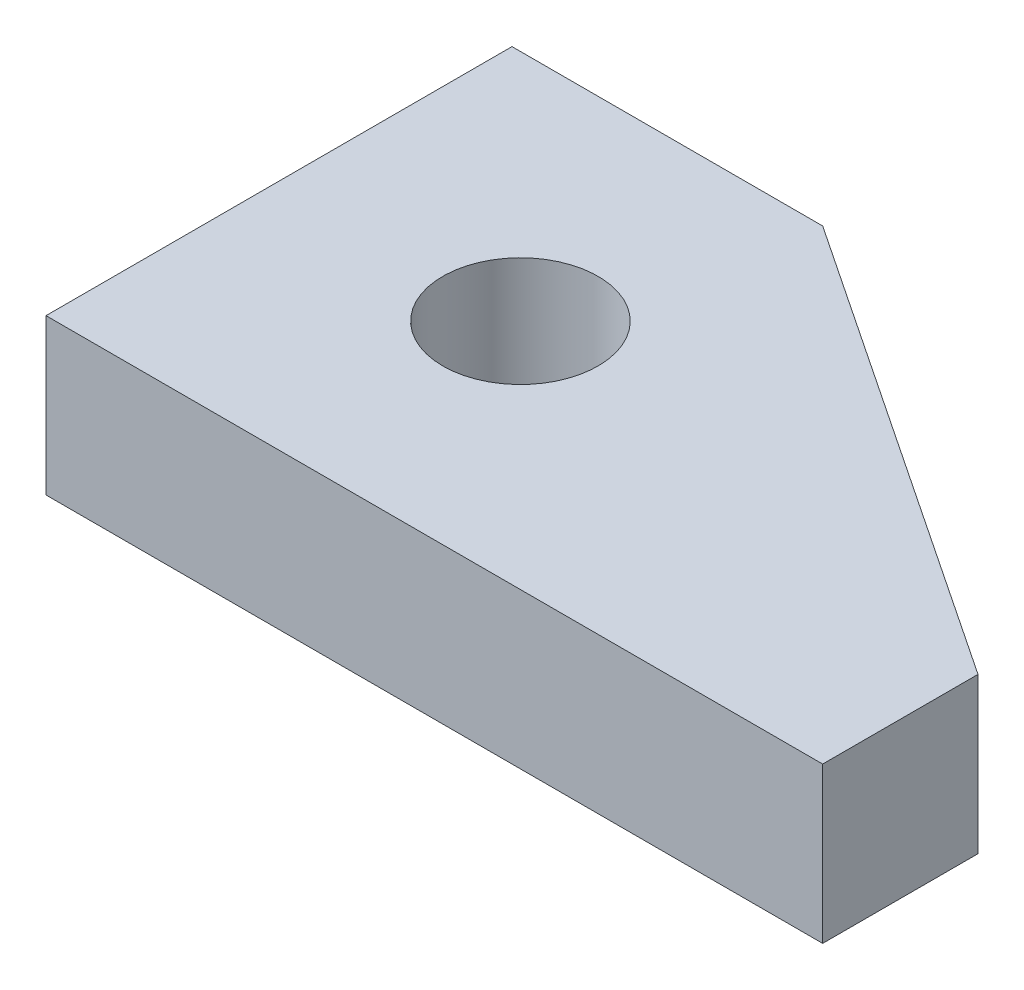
SolidWorks part; units mm, degrees
ref_plane "Plano frontal" through (0, 0, 0) normal (0, 0, 1) x (1, 0, 0)
ref_plane "Plano superior" through (0, 0, 0) normal (0, 1, 0) x (1, 0, 0)
ref_plane "Plano direito" through (0, 0, 0) normal (1, 0, 0) x (0, 0, -1)
sketch "Esboço1" plane through (0, 0, 0) normal (0, 1, 0) x (1, 0, 0)
  line L0 (0, 0) -> (0, -30)
  line L1 (0, -30) -> (50, -30)
  line L2 (50, -30) -> (50, -20)
  line L3 (0, 0) -> (20, 0)
  line L4 (20, 0) -> (50, -20)
  dimension "D1" = 30
  dimension "D2" = 50
  dimension "D3" = 10
  dimension "D4" = 20
extrude "Ressalto-extrusão1" add sketch "Esboço1" along normal blind 10
sketch "Esboço2" plane through (0, 10, 0) normal (0, 1, 0) x (1, 0, 0)
  circle A0 centre (15.5792, -15.0361) radius 5
  dimension "D1" = 10
extrude "Corte-extrusão1" cut sketch "Esboço2" against normal blind 10 contours A0
